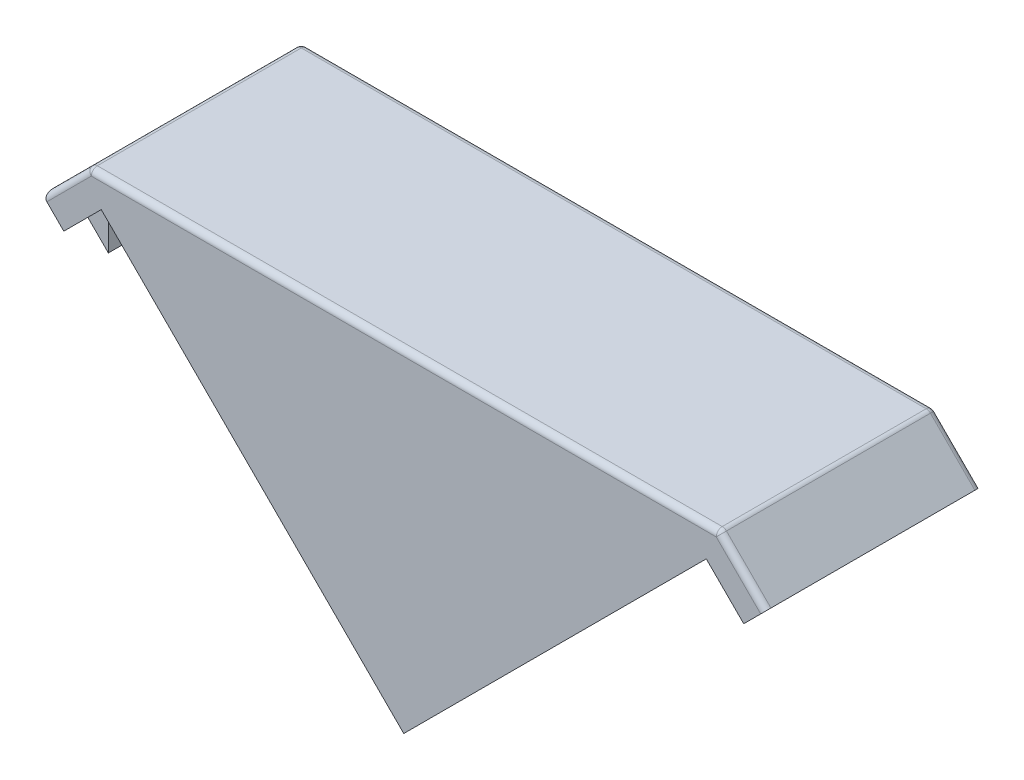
SolidWorks part; units mm, degrees
ref_plane "Спереди" through (0, 0, 0) normal (0, 0, 1) x (1, 0, 0)
ref_plane "Сверху" through (0, 0, 0) normal (0, 1, 0) x (1, 0, 0)
ref_plane "Справа" through (0, 0, 0) normal (1, 0, 0) x (0, 0, -1)
imported_body "1059cap.STEP"
fillet "Скругление1" radius 1
